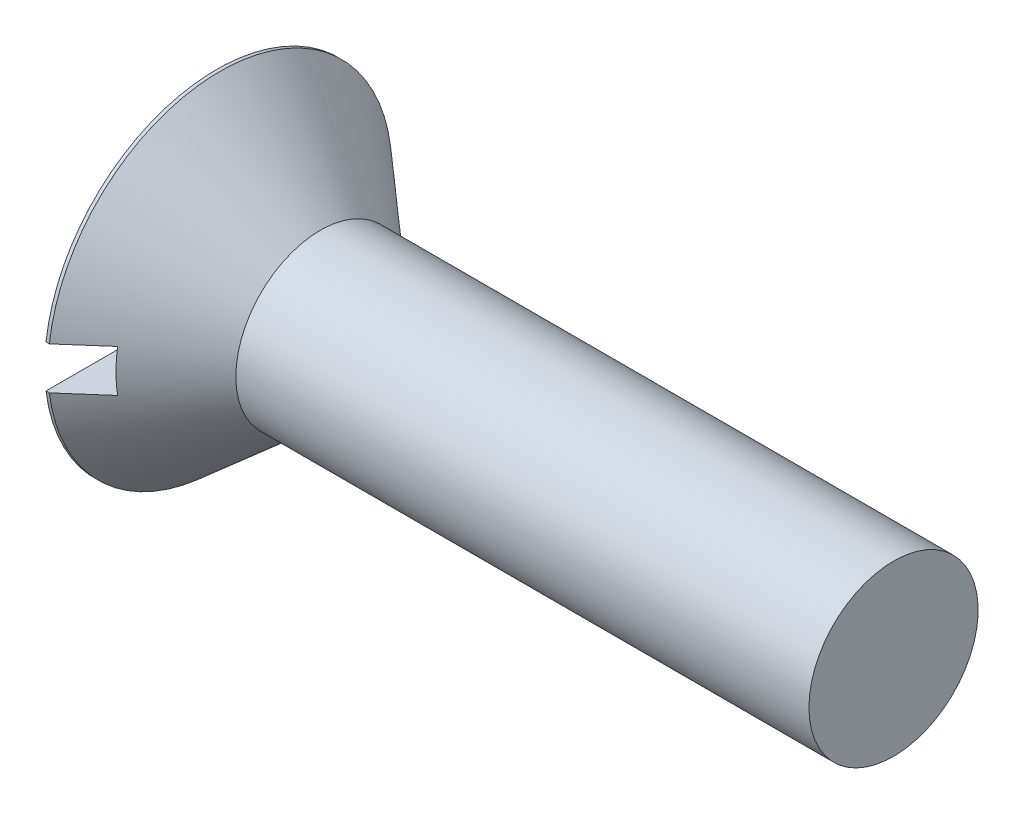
SolidWorks part; units mm, degrees
ref_plane "Plane1" through (0, 0, 0) normal (0, 0, 1) x (1, 0, 0)
ref_plane "Plane2" through (0, 0, 0) normal (0, 1, 0) x (1, 0, 0)
ref_plane "Plane3" through (0, 0, 0) normal (1, 0, 0) x (0, 0, -1)
sketch "BodySke" plane through (0, 0, 0) normal (0, 0, 1) x (1, 0, 0)
  line L0 (0, 0) -> (0, 9.6774)
  line L1 (0, 9.6774) -> (0.1881, 9.6774)
  line L2 (5.842, 4.7625) -> (38.1, 4.7625)
  line L3 (38.1, 4.7625) -> (38.1, 0)
  line L4 (38.1, 0) -> (0, 0)
  line L5 (-6.35, 0) -> (82.55, 0) construction
  line L6 (5.842, -4.7625) -> (38.1, -4.7625) construction
  line L7 (0.1881, -9.6774) -> (5.842, -4.7625) construction
  line L8 (0.1881, 9.6774) -> (5.842, 4.7625)
  line L9 (0, -9.6774) -> (0.1881, -9.6774) construction
  line L10 (7.4295, 6.35) -> (7.4295, -3.175) construction
  line L11 (6.35, 6.35) -> (6.35, -3.175) construction
  dimension "Diameter" = 9.525
  dimension "Length" = 38.1
  dimension "Head_ht" = 5.842
  dimension "Head_dia" = 19.3548
  dimension "Head_ang" = 82
  dimension "D6" = 0.1881
  dimension "Advance" = 1.5875
  dimension "Thread_nom" = 31.75
revolve "Base-Revolve" add sketch "BodySke" angle 360 about L5
sketch "Sketch2" plane through (0, 0, 0) normal (-1, 0, 0) x (0, 0, 1)
  line L0 (-9.6774, -1.1938) -> (9.6774, -1.1938)
  line L1 (-9.6774, -1.1938) -> (-9.6774, 1.1938)
  line L2 (9.6774, 1.1938) -> (-9.6774, 1.1938)
  line L3 (9.6774, 1.1938) -> (9.6774, -1.1938)
  dimension "D1" = 1.1938
  dimension "Slot_width" = 2.3876
  dimension "D2" = 19.3548
  dimension "D3" = 9.6774
extrude "Slot" cut sketch "Sketch2" against normal blind 2.2352
sketch "Sketch3" plane through (0, 0, 0) normal (-1, 0, 0) x (0, 0, 1)
  line L0 (-1.0922, 6.6421) -> (1.0922, 6.6421)
  line L1 (1.0922, 6.6421) -> (1.0922, -6.6421)
  line L2 (1.0922, -6.6421) -> (-1.0922, -6.6421)
  line L3 (-1.0922, -6.6421) -> (-1.0922, 6.6421)
  dimension "D1" = 6.6421
  dimension "Cross_dia" = 13.2842
  dimension "D2" = 1.0922
  dimension "Cross_width" = 2.1844
ref_plane "Plane4" through (7.9756, 0, 0) normal (-1, 0, 0) x (0, 0, 1)
sketch "Sketch4" plane through (7.9756, 0, 0) normal (-1, 0, 0) x (0, 0, 1)
  line L0 (-0.5461, 0.5461) -> (0.5461, 0.5461)
  line L3 (0.5461, 0.5461) -> (0.5461, -0.5461)
  line L4 (0.5461, -0.5461) -> (-0.5461, -0.5461)
  line L5 (-0.5461, -0.5461) -> (-0.5461, 0.5461)
  dimension "D1" = 1.0922
  dimension "D2" = 1.0922
  dimension "D3" = 0.5461
  dimension "D4" = 0.5461
loft "Cross" cut profiles "Sketch3", "Sketch4"
pattern_circular "CirPattern1" count 2 every 90 about axis through (0, 0, 0) along (1, 0, 0) of "Cross"
sketch "ThdSchSke" plane through (0, 0, 0) normal (0, 0, 1) x (1, 0, 0)
  line L0 (7.4295, -3.9624) -> (6.8693, -4.7625)
  line L1 (7.4295, -3.9624) -> (7.9898, -4.7625)
  line L2 (7.9898, -4.7625) -> (7.9898, -5.9531)
  line L3 (-3.175, 0) -> (5.1513, 0) construction
  line L5 (7.9898, -5.9531) -> (6.8693, -5.9531)
  line L6 (6.8693, -5.9531) -> (6.8693, -4.7625)
  line L7 (0, 9.6774) -> (0, 1.1938) construction
  dimension "Thread_minor" = 7.9248
  dimension "Diameter" = 9.525
  dimension "Start" = 7.4295
  dimension "SideAngle" = 55
  dimension "VeeAngle" = 70
  dimension "Overcut" = 11.9063
revolve "ThreadSchematic" [suppressed] cut sketch "ThdSchSke" angle 360 about L3
pattern_linear "ThdSchPat" [suppressed]
equation "\"D1@Sketch3\" = \"Cross_dia@Sketch3\" / 2"
equation "\"D2@Sketch3\" = \"Cross_width@Sketch3\" / 2"
equation "\"D1@Sketch4\" = \"Cross_width@Sketch3\" *.5"
equation "\"D2@Sketch4\" = \"D1@Sketch4\""
equation "\"D4@Sketch4\" = \"D2@Sketch4\" / 2"
equation "\"D3@Sketch4\" = \"D1@Sketch4\" / 2"
equation "\"D1@Sketch2\" = \"Slot_width@Sketch2\" / 2"
equation "\"D2@Sketch2\" = \"Head_dia@BodySke\""
equation "\"D3@Sketch2\" = \"D2@Sketch2\" / 2"
equation "\"Thread_length@ThreadCosmetic\" = ((sgn( (\"Length@BodySke\" - \"Advance@BodySke\" - \"Head_ht@BodySke\" ) - \"Thread_nom@BodySke\" )-1)*( (\"Length@BodySke\" - \"Advance@BodySke\" - \"Head_ht@BodySke\" ) - \"Thread_"
equation "\"Thread_minor@ThdSchSke\" = \"Thread_minor@ThreadCosmetic\""
equation "\"Diameter@ThdSchSke\" = \"Diameter@BodySke\""
equation "\"Overcut@ThdSchSke\" = \"Diameter@BodySke\" * 1.25"
equation "\"Start@ThdSchSke\" = 0.000001 + \"Length@BodySke\" - \"Thread_length@ThreadCosmetic\"  '---Countersunk---"
equation "\"Num_threads@ThdSchPat\" = int( \"Thread_length@ThreadCosmetic\" / \"Advance@BodySke\" + 0.999 )  + 1"
equation "\"Advance@ThdSchPat\" = \"Thread_length@ThreadCosmetic\" /  (\"Num_threads@ThdSchPat\" - 1) 'relax it"
